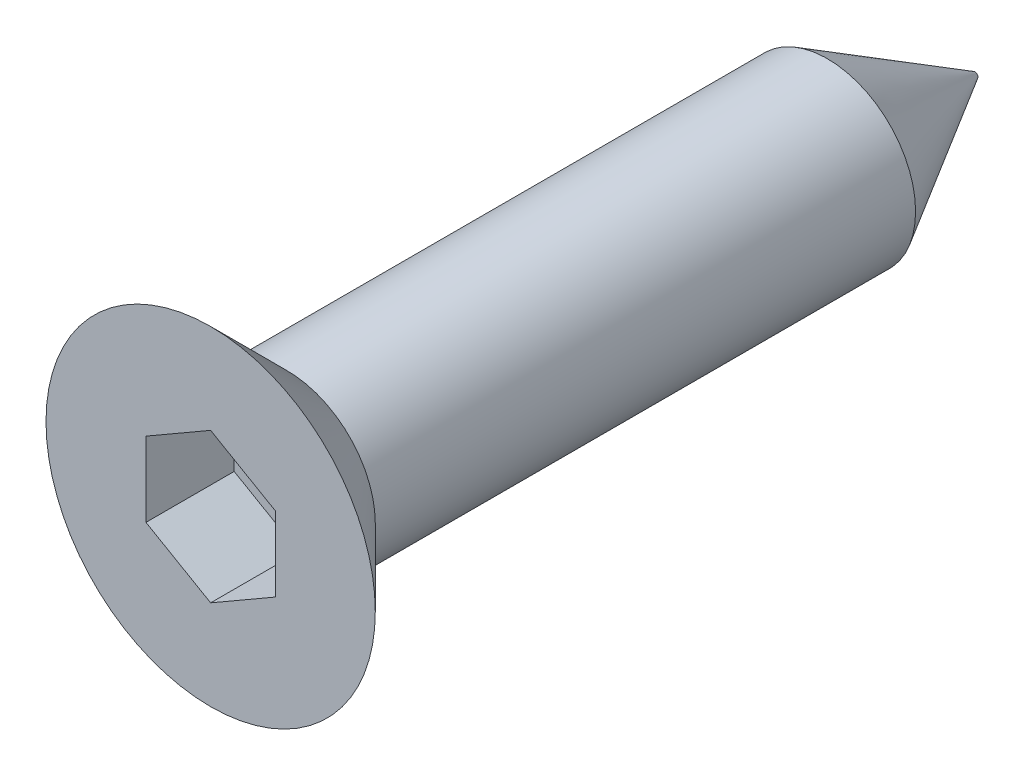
SolidWorks part; units mm, degrees
ref_plane "Plan de face" through (0, 0, 0) normal (0, 0, 1) x (1, 0, 0)
ref_plane "Plan de dessus" through (0, 0, 0) normal (0, 1, 0) x (1, 0, 0)
ref_plane "Plan de droite" through (0, 0, 0) normal (1, 0, 0) x (0, 0, -1)
sketch "Esquisse1" plane through (0, 0, 0) normal (1, 0, 0) x (0, 0, -1)
  line L0 (-1.6035, 0) -> (7.1529, 0) construction
  line L1 (0, 5.0438) -> (0, -4.594) construction
  line L2 (0, 2.8) -> (1.3, 1.5)
  line L3 (1.3, 1.5) -> (1.3, 0)
  line L4 (-1.442, 2.8) -> (2.7621, 2.8) construction
  line L5 (0, 2.8) -> (8.0274, -5.2274) construction
  line L6 (-1.0988, 1.5) -> (4.1029, 1.5) construction
  line L7 (1.3, 0) -> (0, 0)
  line L9 (0, 2.8) -> (0, 0)
revolve "Révolution2" add sketch "Esquisse1" angle 360 about L0
sketch "Esquisse3" plane through (0, 0, 0) normal (0, 0, 1) x (1, 0, 0)
  circle A0 centre (0, 0) radius 1.5
extrude "Extrusion1" add sketch "Esquisse3" against normal blind 13
sketch "Esquisse2" plane through (0, 0, 0) normal (0, 0, 1) x (1, 0, 0)
  line L1 (0, 1.2702) -> (-1.1, 0.6351)
  line L2 (-1.1, 0.6351) -> (-1.1, -0.6351)
  line L3 (-1.1, -0.6351) -> (0, -1.2702)
  line L4 (0, -1.2702) -> (1.1, -0.6351)
  line L5 (1.1, -0.6351) -> (1.1, 0.6351)
  line L6 (1.1, 0.6351) -> (0, 1.2702)
  circle A0 centre (0, 0) radius 1.8 construction
  circle A1 centre (0, 0) radius 1.1 construction
extrude "Enlèv. mat.-Extru.2" cut sketch "Esquisse2" against normal blind 1.5
chamfer "Chanfrein1" distance 1.45 angle 60 1 edges at (1.5, 0, -13)
